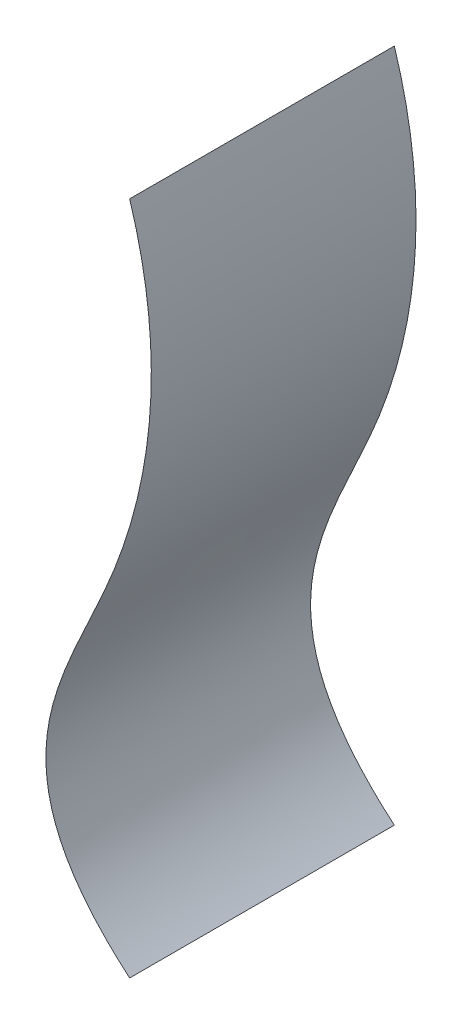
SolidWorks part; units mm, degrees
ref_plane "Front Plane" through (0, 0, 0) normal (0, 0, 1) x (1, 0, 0)
ref_plane "Top Plane" through (0, 0, 0) normal (0, 1, 0) x (1, 0, 0)
ref_plane "Right Plane" through (0, 0, 0) normal (1, 0, 0) x (0, 0, -1)
sketch "Sketch1" plane through (0, 0, 0) normal (0, 0, 1) x (1, 0, 0)
  spline S0 degree 3 poles (-7.2951, 103.2021) (2.3305, 72.6108) (-3.8861, 10.0429) (-46.1015, -42.3156) (-7.2951, -75.2415) knots 0 0 0 0 0.490733 1 1 1 1
surface "Surface-Extrude1" sketch "Sketch1" parameters "D1"=70
ref_plane "Plane1" through (-60, 0, 0) normal (1, 0, 0) x (0, 0, -1)
sketch "Sketch2" plane through (-60, 0, 0) normal (1, 0, 0) x (0, 0, -1)
  spline S0 degree 3 poles (-27.4822, -3.4963) (4.7074, 12.1953) (-36.5812, 29.3189) (8.5158, 81.152) (3.5413, 16.349) (27.2154, 39.4614) knots 0 0 0 0 0.413924 0.622093 1 1 1 1
sketch "Sketch3" plane through (0, 0, 0) normal (0, 0, 1) x (1, 0, 0)
  spline S0 degree 3 poles (133.7983, 92.2914) (60.5541, 45.6533) (175.3369, 16.9751) (116.0845, -52.8247) (133.7983, -76.0707) knots 0 0 0 0 0.566154 1 1 1 1
